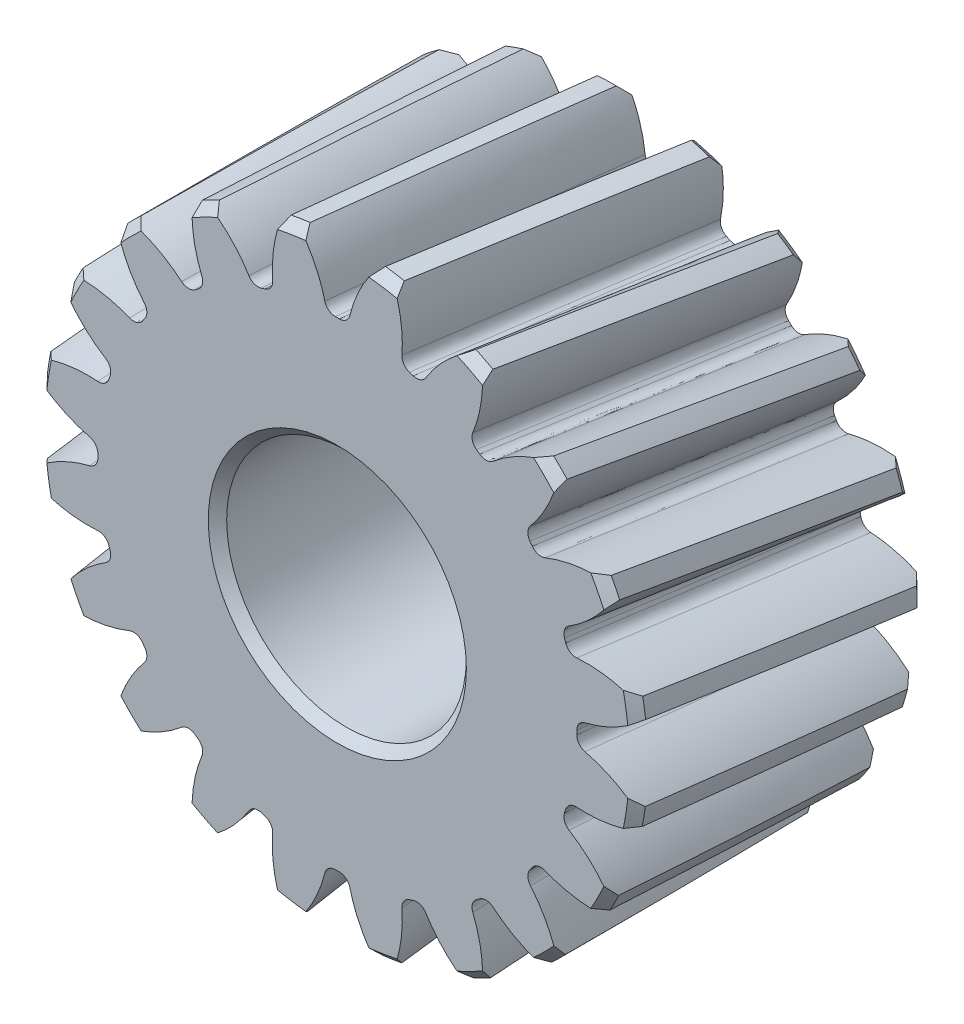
SolidWorks part; units mm, degrees
ref_plane "Front Plane" through (0, 0, 0) normal (0, 0, 1) x (1, 0, 0)
ref_plane "Top Plane" through (0, 0, 0) normal (0, 1, 0) x (1, 0, 0)
ref_plane "Right Plane" through (0, 0, 0) normal (1, 0, 0) x (0, 0, -1)
sketch "Sketch1" plane through (0, 0, 0) normal (0, 0, 1) x (1, 0, 0)
  line L0 (0, 0) -> (0, 2) construction
  line L1 (-0.6428, 2.234) -> (0.6428, 1.766) construction
  circle A0 centre (0, 0) radius 1.75 construction
  circle A1 centre (0, 0) radius 2.2 construction
  circle A2 centre (0, 0) radius 2 construction
  circle A3 centre (0, 0) radius 1.8794 construction
  circle A5 centre (0, 0) radius 0.875 construction
  point P8 (0.1, 0)
  point P13 (10, 0)
sketch "Sketch2" plane through (0, 0, 0) normal (1, 0, 0) x (0, 0, -1)
  line L0 (-1.05, 0) -> (1.05, 0) construction
  line L1 (1.05, 2.2) -> (1.05, -2.2) construction
  line L3 (-1.05, 2.2) -> (1.05, 2.2) construction
  line L4 (0, 12.5) -> (0, -12.5) construction
  line L5 (-1.05, 12.5) -> (-1.05, -12.5) construction
  line L6 (0, 2.4977) -> (0, -2.4977) construction
  point P2 (0, 2.2)
  dimension "Overall Width" = 2.1
  dimension "Face Width" = 1.05
sketch "Sketch3" plane through (0, 0, 0) normal (0, 0, 1) x (1, 0, 0)
  circle A0 centre (0, 0) radius 2.2
  circle A1 centre (0, 0) radius 2.2 construction
extrude "Boss-Extrude1" add sketch "Sketch3" against normal up to vertex (1.05 mm away) and the other way up to vertex (1.05 mm away)
sketch "Sketch5" plane through (0, 0, 0) normal (1, 0, 0) x (0, 0, -1)
  line L5 (-1.05, 0) -> (1.05, 0)
  line L6 (-1.05, 0) -> (-1.05, 0.875)
  line L7 (-1.05, 0.875) -> (1.05, 0.875)
  line L8 (1.05, 0) -> (1.05, 0.875)
  point P12 (0, 0.875)
revolve "Cut-Revolve1" cut sketch "Sketch5" angle 360 about L0
chamfer "Chamfer2" distance 0.0671 angle 45 4 edges at (2.2, 0, -1.05) (0.875, 0, -1.05) (0.875, 0, 1.05) (2.2, 0, 1.05)
sketch "Sketch4" plane through (0, 0, 0) normal (0, 0, 1) x (1, 0, 0)
  line L0 (1.7482, -0.0785) -> (1.7482, 0.0785)
  arc A3 (2.1827, 0.2754) -> (2.1827, -0.2754) centre (0, 0) cw
  circle A4 centre (0, 0) radius 2.2 construction
  arc A5 (2.1827, 0.2754) -> (1.7482, 0.0785) centre (1.5748, 1.0393) cw
  circle A6 centre (0, 0) radius 1.75 construction
  arc A7 (2.1827, -0.2754) -> (1.7482, -0.0785) centre (1.5748, -1.0393) ccw
  spline S0 degree 4 poles (1.8756, 0.1195) (1.8761, 0.1196) (1.8775, 0.1197) (1.8802, 0.12) (1.8847, 0.1207) (1.8903, 0.1217) (1.8975, 0.1231) (1.906, 0.1251) (1.9152, 0.1276) (1.9253, 0.1305) (1.9353, 0.1337) (1.9452, 0.1371) (1.955, 0.1407) (1.9669, 0.1453) (1.981, 0.1511) (1.9974, 0.1584) (2.0159, 0.1673) (2.0346, 0.177) (2.0529, 0.187) (2.0712, 0.1976) (2.0888, 0.2084) (2.1068, 0.2201) (2.1235, 0.2312) (2.1417, 0.2442) (2.1567, 0.2551) (2.1798, 0.2729) (2.1896, 0.2808) (2.2043, 0.2929) (2.2092, 0.2971) knots 0 0 0 0 0 0.005377 0.015084 0.028532 0.04661 0.064855 0.092111 0.119476 0.146842 0.174209 0.201575 0.228941 0.256307 0.307035 0.361767 0.4165 0.471232 0.525964 0.580697 0.635429 0.690161 0.744894 0.799626 0.854358 0.909091 1 1 1 1 1 construction
  spline S1 degree 4 poles (1.8756, 0.1195) (1.8761, 0.1196) (1.8775, 0.1197) (1.8802, 0.12) (1.8847, 0.1207) (1.8903, 0.1217) (1.8975, 0.1231) (1.906, 0.1251) (1.9152, 0.1276) (1.9253, 0.1305) (1.9353, 0.1337) (1.9452, 0.1371) (1.955, 0.1407) (1.9669, 0.1453) (1.981, 0.1511) (1.9974, 0.1584) (2.0159, 0.1673) (2.0346, 0.177) (2.0529, 0.187) (2.0712, 0.1976) (2.0888, 0.2084) (2.1068, 0.2201) (2.1235, 0.2312) (2.1417, 0.2442) (2.1567, 0.2551) (2.1716, 0.2666) (2.179, 0.2724) (2.1827, 0.2754) knots 0 0 0 0 0 0.005377 0.015084 0.028532 0.04661 0.064855 0.092111 0.119476 0.146842 0.174209 0.201575 0.228941 0.256307 0.307035 0.361767 0.4165 0.471232 0.525964 0.580697 0.635429 0.690161 0.744894 0.799626 0.854358 0.909091 0.909091 0.909091 0.909091 0.909091 construction
  spline S2 degree 4 poles (1.8756, -0.1195) (1.8761, -0.1196) (1.8775, -0.1197) (1.8802, -0.12) (1.8847, -0.1207) (1.8903, -0.1217) (1.8975, -0.1231) (1.906, -0.1251) (1.9152, -0.1276) (1.9253, -0.1305) (1.9353, -0.1337) (1.9452, -0.1371) (1.955, -0.1407) (1.9669, -0.1453) (1.981, -0.1511) (1.9974, -0.1584) (2.0159, -0.1673) (2.0346, -0.177) (2.0529, -0.187) (2.0712, -0.1976) (2.0888, -0.2084) (2.1068, -0.2201) (2.1235, -0.2312) (2.1417, -0.2442) (2.1567, -0.2551) (2.1798, -0.2729) (2.1896, -0.2808) (2.2043, -0.2929) (2.2092, -0.2971) knots 0 0 0 0 0 0.005377 0.015084 0.028532 0.04661 0.064855 0.092111 0.119476 0.146842 0.174209 0.201575 0.228941 0.256307 0.307035 0.361767 0.4165 0.471232 0.525964 0.580697 0.635429 0.690161 0.744894 0.799626 0.854358 0.909091 1 1 1 1 1 construction
  spline S3 degree 4 poles (1.8756, -0.1195) (1.8761, -0.1196) (1.8775, -0.1197) (1.8802, -0.12) (1.8847, -0.1207) (1.8903, -0.1217) (1.8975, -0.1231) (1.906, -0.1251) (1.9152, -0.1276) (1.9253, -0.1305) (1.9353, -0.1337) (1.9452, -0.1371) (1.955, -0.1407) (1.9669, -0.1453) (1.981, -0.1511) (1.9974, -0.1584) (2.0159, -0.1673) (2.0346, -0.177) (2.0529, -0.187) (2.0712, -0.1976) (2.0888, -0.2084) (2.1068, -0.2201) (2.1235, -0.2312) (2.1417, -0.2442) (2.1567, -0.2551) (2.1716, -0.2666) (2.179, -0.2724) (2.1827, -0.2754) knots 0 0 0 0 0 0.005377 0.015084 0.028532 0.04661 0.064855 0.092111 0.119476 0.146842 0.174209 0.201575 0.228941 0.256307 0.307035 0.361767 0.4165 0.471232 0.525964 0.580697 0.635429 0.690161 0.744894 0.799626 0.854358 0.909091 0.909091 0.909091 0.909091 0.909091 construction
sketch "Sketch6" plane through (0, 0, 1.05) normal (0, 0, 1) x (1, 0, 0)
  circle A0 centre (0, 0) radius 2.2 construction
  circle A1 centre (0, 0) radius 2.2
curve "Helix/Spiral1"
sketch "Sketch7" plane through (0, 0, 1.05) normal (0, 0, 1) x (1, 0, 0)
  line L1 (1.7482, 0.0785) -> (1.7482, -0.0785)
  line L2 (1.7482, 0.0785) -> (1.7482, -0.0785)
  arc A3 (1.7482, 0.0785) -> (2.1827, 0.2754) centre (1.5748, 1.0393) ccw
  arc A4 (2.1827, -0.2754) -> (2.1827, 0.2754) centre (0, 0) ccw
  arc A5 (2.1827, -0.2754) -> (1.7482, -0.0785) centre (1.5748, -1.0393) ccw
  arc A6 (1.7482, 0.0785) -> (2.1827, 0.2754) centre (1.5748, 1.0393) ccw
  arc A7 (2.1827, -0.2754) -> (2.1827, 0.2754) centre (0, 0) ccw
  arc A8 (2.1827, -0.2754) -> (1.7482, -0.0785) centre (1.5748, -1.0393) ccw
  dimension "D1" = 0
sweep "Cut-Sweep1" cut profiles "Sketch7" path "Helix/Spiral1"
fillet "Fillet1" radius 0.0785 2 edges
pattern_circular "CirPattern1" count 20 over 360 about axis through (0, 0, -1.05) along (0, 0, 1) of "Cut-Sweep1", "Fillet1"
equation "\"Number of Teeth\"= 20"
equation "\"Module\"= 0.2"
equation "\"Diametral Pitch\"= 1 / \"Module\""
equation "\"Dedendum\"= 1.25 / \"Diametral Pitch\""
equation "\"Pitch Diameter\"= \"Module\" * \"Number of Teeth\""
equation "\"Root Diameter\"= \"Pitch Diameter\" - ( 2 * \"Dedendum\" )"
equation "\"Root Diameter@Sketch1\"=\"Root Diameter\""
equation "\"OD@Sketch1\" = \"Outside Diameter\""
equation "\"D1@CirPattern1\"= \"Number of Teeth\""
equation "\"Pressure Angle\"= 20"
equation "\"Base Diameter\"= \"Pitch Diameter\" * cos ( \"Pressure Angle\" )"
equation "\"Outside Diameter\"= ( \"Number of Teeth\" + 2 ) / \"Diametral Pitch\""
equation "\"Pitch Angle\"= 360deg / \"Number of Teeth\""
equation "\"Alpha\"= sqr ( \"Pitch Diameter\" ^ 2 - \"Base Diameter\" ^ 2 ) / \"Base Diameter\" * 180 / PI - \"Pressure Angle\""
equation "\"Beta\"= ( \"Pitch Angle\" / 4 - \"Alpha\" )"
equation "\"Phi\"= sqr ( ( \"Outside Diameter\" / 2 ) ^ 2 - ( \"Base Diameter\" / 2 ) ^ 2 ) / ( \"Base Diameter\" / 2 )"
equation "\"Addendum\"= 1 / \"Diametral Pitch\""
equation "\"WorkingDepth\"= 2 / \"Diametral Pitch\""
equation "\"WholeDepth\"= 2.25 / \"Diametral Pitch\""
equation "\"Clearance\"= 0.25 / \"Diametral Pitch\""
equation "\"ToothThickness\"= ( pi * 2 ) / \"Diametral Pitch\""
equation "\"CircularPitch\"= pi / \"Diametral Pitch\""
equation "\"Number of Teeth@Sketch1\"=\"Number of Teeth\""
equation "\"Module@Sketch1\"=\"Module\""
equation "\"Pressure Angle@Sketch1\"=\"Pressure Angle\""
equation "\"Gear Pitch Diameter@Sketch1\"=\"Pitch Diameter\""
equation "\"Base Diameter@Sketch1\"=\"Base Diameter\""
equation "\"Fillet\"= \"Clearance\" * cos ( \"Pressure Angle\" ) * tan ( ( 90 + \"Pressure Angle\" ) / 2 )"
equation "\"D1\"= \"Fillet\""
equation "\"D1\"= \"Set Screw Pitch@Sketch1\" * .75"
equation "\"D1\"= \"Set Screw Diameter@Sketch1\" / 2"
equation "\"D3\"= \"Set Screw Pitch@Sketch1\" +  ( \"Hub Diameter@Sketch1\" / 2 ) "
equation "\"D4\"= \"Set Screw Pitch@Sketch1\""
equation "\"D2\"= \"Fillet\" * 2"
equation "\"D1\"= \"Fillet\" * 2"
equation "\"D1@Chamfer2\"=\"Fillet\""
equation "\"D1@Sketch4\"=\"CircularPitch\"*0.25"
equation "\"D1@Fillet1\"=\"CircularPitch\"*0.125"
